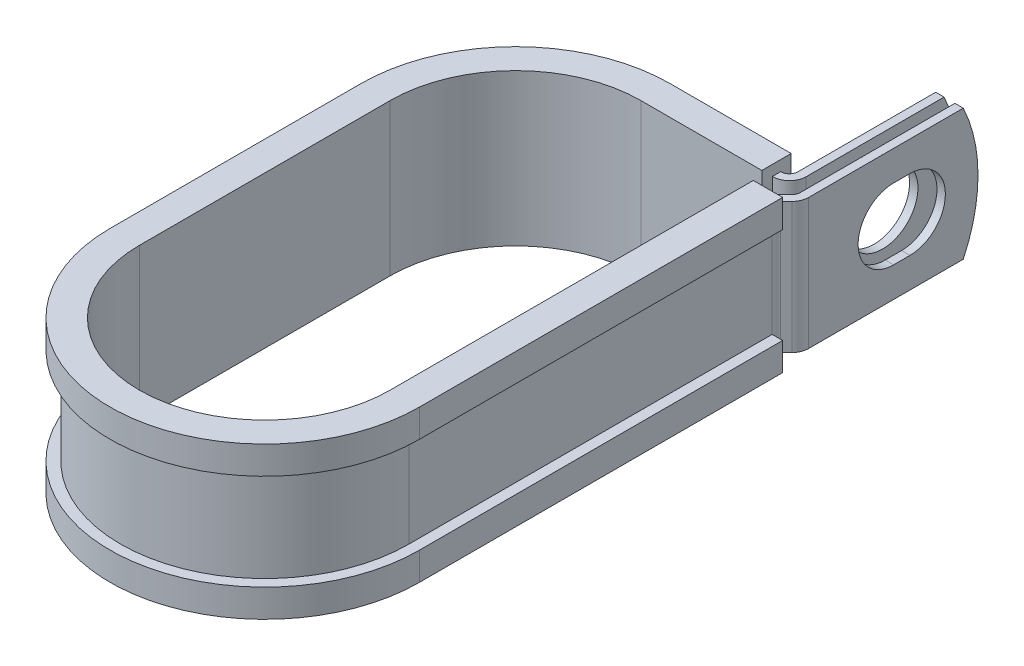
SolidWorks part; units mm, degrees
ref_plane "Front Plane" through (0, 0, 0) normal (0, 0, 1) x (1, 0, 0)
ref_plane "Top Plane" through (0, 0, 0) normal (0, 1, 0) x (1, 0, 0)
ref_plane "Right Plane" through (0, 0, 0) normal (1, 0, 0) x (0, 0, -1)
sketch "Sketch1" plane through (0, 0, 0) normal (0, 1, 0) x (1, 0, 0)
  line L0 (0, 19.7739) -> (17.6582, 19.7739)
  line L1 (19.7739, 0) -> (19.7739, 16.3614)
  line L2 (20.0966, 44.4246) -> (20.0966, 22.2123)
  line L3 (20.4881, 18.0856) -> (21.3143, 18.9118)
  line L4 (-19.7739, 0) -> (-19.7739, -36.4998)
  line L5 (21.6714, 19.7739) -> (21.6714, 44.4246)
  line L6 (19.7739, 0) -> (19.7739, -36.4998)
  arc A0 (0, 19.7739) -> (-19.7739, 0) centre (0, 0) ccw
  arc A1 (20.4881, 18.0856) -> (19.7739, 16.3614) centre (22.2123, 16.3614) ccw
  arc A2 (21.3143, 18.9118) -> (21.6714, 19.7739) centre (20.4522, 19.7739) ccw
  arc A3 (17.6582, 19.7739) -> (20.0966, 22.2123) centre (17.6582, 22.2123) ccw
  arc A4 (-19.7739, -36.4998) -> (19.7739, -36.4998) centre (0, -36.4998) ccw
extrude "Extrude-Thin1" add sketch "Sketch1" along normal mid plane 19.05 thin
sketch "Sketch2" plane through (18.8774, 0, 0) normal (-1, 0, 0) x (0, 0, 1)
  line L0 (-44.4246, 9.525) -> (-44.4246, -9.525) construction
  line L1 (0, 9.525) -> (0, -9.525) construction
  circle A0 centre (-33.3248, 0) radius 5.1562
  point P2 (-44.4246, 0)
extrude "Cut-Extrude1" cut sketch "Sketch2" against normal up to surface (1.2192 mm away)
sketch "Sketch3" plane through (22.8906, 0, 0) normal (1, 0, 0) x (0, 0, -1)
  line L0 (32.131, 0) -> (34.5186, 0) construction
  line L1 (32.131, 5.1562) -> (34.5186, 5.1562)
  line L2 (32.131, -5.1562) -> (34.5186, -5.1562)
  line L3 (44.4246, 9.525) -> (44.4246, -9.525) construction
  arc A0 (32.131, 5.1562) -> (32.131, -5.1562) centre (32.131, 0) ccw
  arc A1 (34.5186, -5.1562) -> (34.5186, 5.1562) centre (34.5186, 0) ccw
  point P3 (33.3248, 0)
  point P8 (44.4246, 0)
  point P11 (26.9748, 0)
  point P12 (39.6748, 0)
extrude "Cut-Extrude2" cut sketch "Sketch3" against normal up to surface (1.2192 mm away)
sketch "Sketch4" plane through (18.8774, 0, 0) normal (-1, 0, 0) x (0, 0, 1)
  line L0 (-44.4246, 9.525) -> (-44.4246, -9.525)
  line L1 (-44.4246, 9.525) -> (-42.2801, 9.525)
  line L2 (-44.4246, 9.525) -> (-22.2123, 9.525) construction
  line L3 (-44.4246, -9.525) -> (-42.2801, -9.525)
  line L4 (-44.4246, -9.525) -> (-22.2123, -9.525) construction
  arc A0 (-42.2801, 9.525) -> (-42.2801, -9.525) centre (-22.1996, 0) ccw
extrude "Cut-Extrude3" cut sketch "Sketch4" against normal through all contours A0 M4 M5 | A0 L0 M2
ref_plane "Plane1" through (0, 0, -16.3614) normal (0, 0, -1) x (-1, 0, 0)
ref_plane "Plane2" through (17.6074, 0, 0) normal (-1, 0, 0) x (0, 0, 1)
sketch "Sketch5" plane through (0, 0, -16.3614) normal (0, 0, -1) x (-1, 0, 0)
  line L0 (-20.9931, 9.525) -> (-19.7739, 9.525)
  line L1 (-20.9931, 9.525) -> (-20.9931, -9.525) construction
  line L3 (-19.7739, 9.525) -> (-19.7739, -9.525)
  line L4 (-19.7739, -9.525) -> (-20.9931, -9.525)
  line L5 (-20.9931, -9.525) -> (-20.9931, -6.985)
  line L6 (-20.9931, 9.525) -> (-20.9931, 6.985)
  line L7 (-22.5171, 11.049) -> (-22.5171, 6.985)
  line L8 (-22.5171, 11.049) -> (-18.2499, 11.049)
  line L9 (-18.2499, 11.049) -> (-18.2499, -11.049)
  line L10 (-18.2499, -11.049) -> (-22.5171, -11.049)
  line L11 (-22.5171, -11.049) -> (-22.5171, -6.985)
  line L12 (-22.5171, 6.985) -> (-20.9931, 6.985)
  line L13 (-20.9931, -6.985) -> (-22.5171, -6.985)
sketch "Sketch6" plane through (0, 9.525, 0) normal (0, 1, 0) x (1, 0, 0)
  line L0 (18.2499, 0) -> (18.2499, 16.3614)
  line L1 (18.2499, 16.3614) -> (22.5171, 16.3614) construction
  line L2 (17.6074, 6.9878) -> (17.6074, -6.9878) construction
  line L3 (18.2499, -36.4998) -> (18.2499, 0)
  line L4 (-18.2499, -36.4998) -> (-18.2499, 0)
  line L5 (0, 18.2499) -> (17.6074, 18.2499)
  arc A0 (0, 18.2499) -> (-18.2499, 0) centre (0, 0) ccw
  arc A1 (-18.2499, -36.4998) -> (18.2499, -36.4998) centre (0, -36.4998) ccw
sweep "Sweep1" add profiles "Sketch5" path "Sketch6"
equation "\"D4@Sketch5\" = \"D1@Extrude-Thin1\""
equation "\"D5@Sketch5\" = \"D5@Extrude-Thin1\""
equation "\"D1@Sketch3\" = \"D2@Sketch2\""
equation "\"D7@Sketch1\" = \"D3@Sketch2\" + \"D1@Sketch3\""
equation "\"D1@Sketch1\" = \"D1@Sketch6\" + 2 * \"D3@Sketch5\""
equation "\"D1@Sketch4\" = ( \"D1@Extrude-Thin1\" + .125 ) * 2"
equation "\"D9@Sketch1\"= \"D5@Extrude-Thin1\""
equation "\"D8@Sketch1\"= 2 * \"D5@Extrude-Thin1\""
equation "\"D2@Sketch1\" = 2 * \"D5@Extrude-Thin1\""
equation "\"D2@Sketch3\" = \"D1@Sketch2\""
equation "\"D6@Sketch1\" = \"D1@Sketch1\""
equation "\"D3@Sketch1\" = \"D1@Sketch6\""
